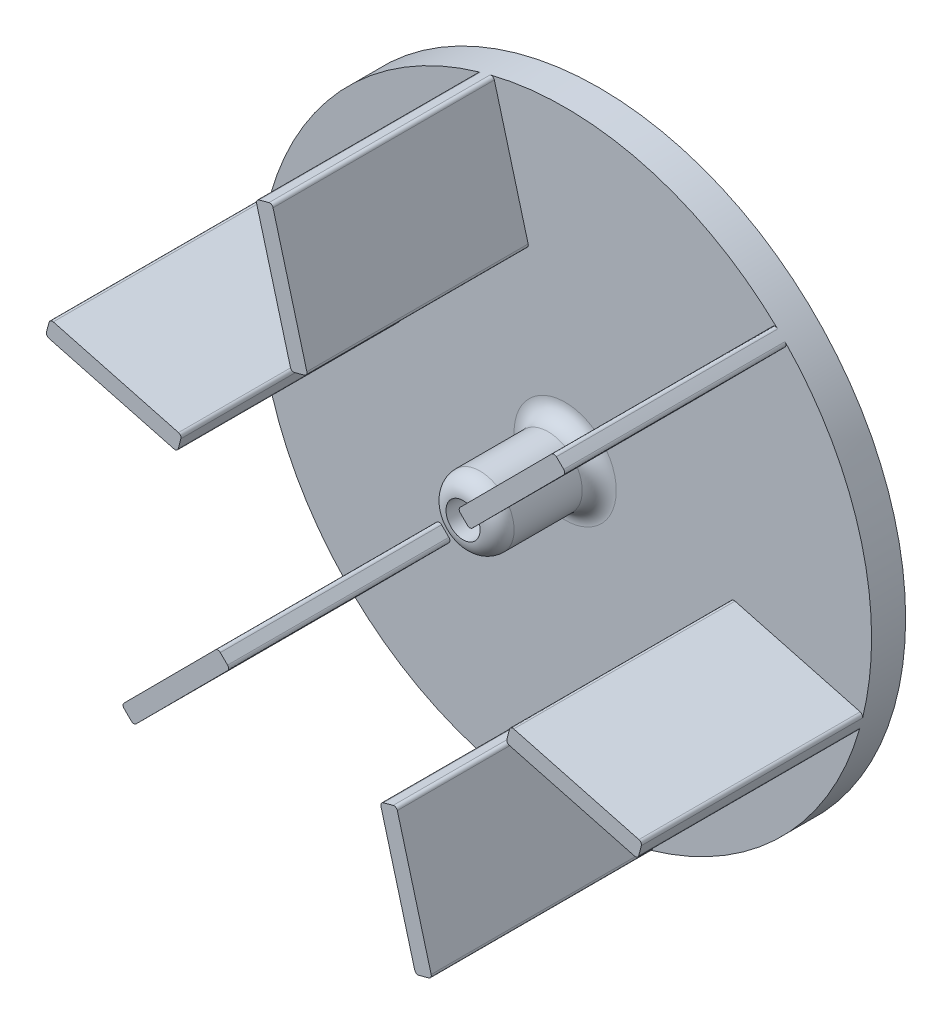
SolidWorks part; units mm, degrees
ref_plane "Front Plane" through (0, 0, 0) normal (0, 0, 1) x (1, 0, 0)
ref_plane "Top Plane" through (0, 0, 0) normal (0, 1, 0) x (1, 0, 0)
ref_plane "Right Plane" through (0, 0, 0) normal (1, 0, 0) x (0, 0, -1)
sketch "Sketch2" plane through (0, 0, 0) normal (0, 0, 1) x (1, 0, 0)
  circle A0 centre (0, 0) radius 18
  circle A1 centre (0, 0) radius 1
  dimension "D1" = 36
  dimension "D2" = 2
extrude "Boss-Extrude1" add sketch "Sketch2" against normal blind 2
sketch "Sketch5" plane through (0, 0, 0) normal (0, 0, 1) x (1, 0, 0)
  circle A0 centre (0, 0) radius 1
  circle A1 centre (0, 0) radius 2
  dimension "D1" = 4
  dimension "D2" = 2
extrude "Boss-Extrude3" add sketch "Sketch5" along normal blind 6
fillet "Fillet6" radius 1 2 edges at (2, 0, 6) (2, 0, 0)
sketch "Sketch6" plane through (0, 0, 0) normal (0, 0, 1) x (1, 0, 0)
  line L0 (0, 0) -> (11.6116, 11.6627) construction
  line L1 (7.401, 6.7249) -> (13.0494, 12.3981)
  line L2 (6.6924, 7.4305) -> (12.3407, 13.1037)
  line L3 (6.6924, 7.4305) -> (7.401, 6.7249)
  circle A0 centre (0, 0) radius 10 construction
  circle A2 centre (0, 0) radius 18 construction
  arc A3 (13.0494, 12.3981) -> (12.3407, 13.1037) centre (0, 0) ccw
  dimension "D1" = 0.5
  dimension "D2" = 0.5
extrude "Boss-Extrude4" add sketch "Sketch6" along normal blind 13
fillet "Fillet7" radius 0.2 4 edges at (6.6924, 7.4305, 6.5) (7.401, 6.7249, 6.5) (13.0494, 12.3981, 6.5) (12.3407, 13.1037, 6.5)
pattern_circular "CirPattern2" count 6 over 360 about axis through (0, 0, 0) along (0, 0, 1) of "Boss-Extrude4", "Fillet7"
